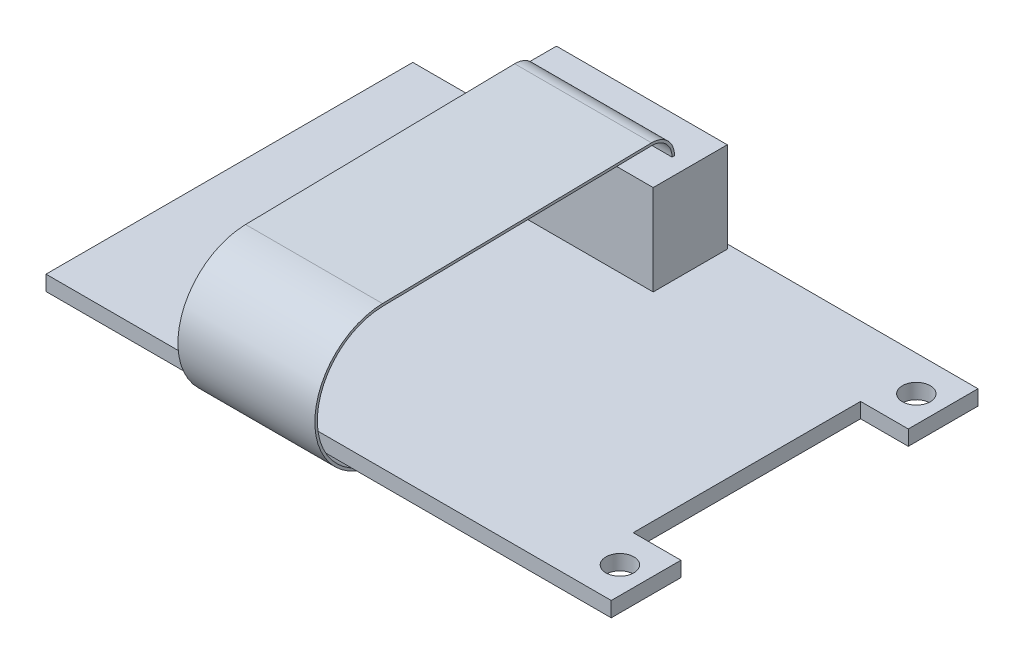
SolidWorks part; units mm, degrees
ref_plane "Front" through (0, 0, 0) normal (0, 0, 1) x (1, 0, 0)
ref_plane "Top" through (0, 0, 0) normal (0, 1, 0) x (1, 0, 0)
ref_plane "Right" through (0, 0, 0) normal (1, 0, 0) x (0, 0, -1)
sketch "Sketch1" plane through (0, 0, 0) normal (0, 1, 0) x (1, 0, 0)
  line L0 (0, -11.4935) -> (0, -18.542)
  line L1 (-57.15, 18.542) -> (0, 18.542)
  line L2 (-57.15, 18.542) -> (-57.15, -18.542)
  line L3 (-57.15, -18.542) -> (0, -18.542)
  line L4 (0, 18.542) -> (0, 11.4935)
  line L5 (0, 11.4935) -> (-4.826, 11.4935)
  line L7 (0, -11.4935) -> (-4.826, -11.4935)
  line L8 (0, 0) -> (-57.15, 0) construction
  line L9 (-4.826, 11.4935) -> (-4.826, -11.4935)
  circle A0 centre (-2.6797, -14.986) radius 1.4097
  circle A1 centre (-2.6797, 14.986) radius 1.4097
  point P15 (-4.826, 0)
  dimension "D6" = 2.8194
  dimension "D7" = 1.27
  dimension "D8" = 32.7914
  dimension "D1" = 37.084
  dimension "D2" = 57.15
  dimension "D3" = 14.986
  dimension "D4" = 14.986
  dimension "D5" = 22.987
  dimension "D9" = 4.826
extrude "Extrude1" add sketch "Sketch1" along normal blind 1.524
sketch "Sketch2" plane through (0, 1.524, 0) normal (0, 1, 0) x (1, 0, 0)
  line L1 (-42.164, 18.0848) -> (-24.892, 18.0848)
  line L2 (-42.164, 18.0848) -> (-42.164, 10.5918)
  line L3 (-42.164, 10.5918) -> (-24.892, 10.5918)
  line L4 (-24.892, 18.0848) -> (-24.892, 10.5918)
  line L5 (0, 18.542) -> (-57.15, 18.542) construction
  line L6 (-57.15, 18.542) -> (-57.15, -18.542) construction
  dimension "D1" = 17.272
  dimension "D2" = 7.493
  dimension "D3" = 14.986
  dimension "D4" = 0.4572
extrude "Header+Conn" add sketch "Sketch2" along normal blind 9.144
sketch "Sketch3" plane through (0, 10.668, 0) normal (0, 1, 0) x (1, 0, 0)
  line L0 (-40.4495, 14.3383) -> (-42.164, 14.3383) construction
  line L1 (-26.6065, 14.2113) -> (-40.4495, 14.2113)
  line L2 (-26.6065, 14.2113) -> (-26.6065, 14.4653)
  line L3 (-26.6065, 14.4653) -> (-40.4495, 14.4653)
  line L4 (-40.4495, 14.2113) -> (-40.4495, 14.4653)
  line L5 (-42.164, 18.0848) -> (-42.164, 10.5918) construction
  line L6 (-33.528, 14.2113) -> (-33.528, 10.5918) construction
  line L7 (-42.164, 10.5918) -> (-24.892, 10.5918) construction
  dimension "D1" = 13.843
  dimension "D2" = 0.254
ref_plane "Plane1" through (-26.6065, 0, 0) normal (1, 0, 0) x (0, 0, -1)
sketch "Sketch4" plane through (-26.6065, 0, 0) normal (1, 0, 0) x (0, 0, -1)
  line L0 (12.1438, 12.6997) -> (-15.0574, 12.2249)
  line L1 (10.5918, 10.668) -> (18.0848, 10.668) construction
  line L2 (12.1438, 12.6997) -> (-11.8828, 12.6997) construction
  line L3 (-14.9403, 5.5149) -> (-15.0574, 12.2249) construction
  line L4 (-14.9403, 5.5149) -> (-16.7901, -0.9362) construction
  arc A0 (14.2113, 10.668) -> (12.1438, 12.6997) centre (12.1793, 10.668) ccw
  arc A1 (-15.0574, 12.2249) -> (-16.7901, -0.9362) centre (-14.9403, 5.5149) ccw
  arc A2 (-16.7901, -0.9362) -> (-15.6193, -2.3971) centre (-17.2367, -2.4937) cw
  dimension "D1" = 2.032
  dimension "D3" = 6.711
  dimension "D4" = 1.6203
  dimension "D2" = 27.2054
  dimension "D5" = 1
  dimension "D6" = 163
sweep "Sweep4" add profiles "Sketch3" path "Sketch4"
